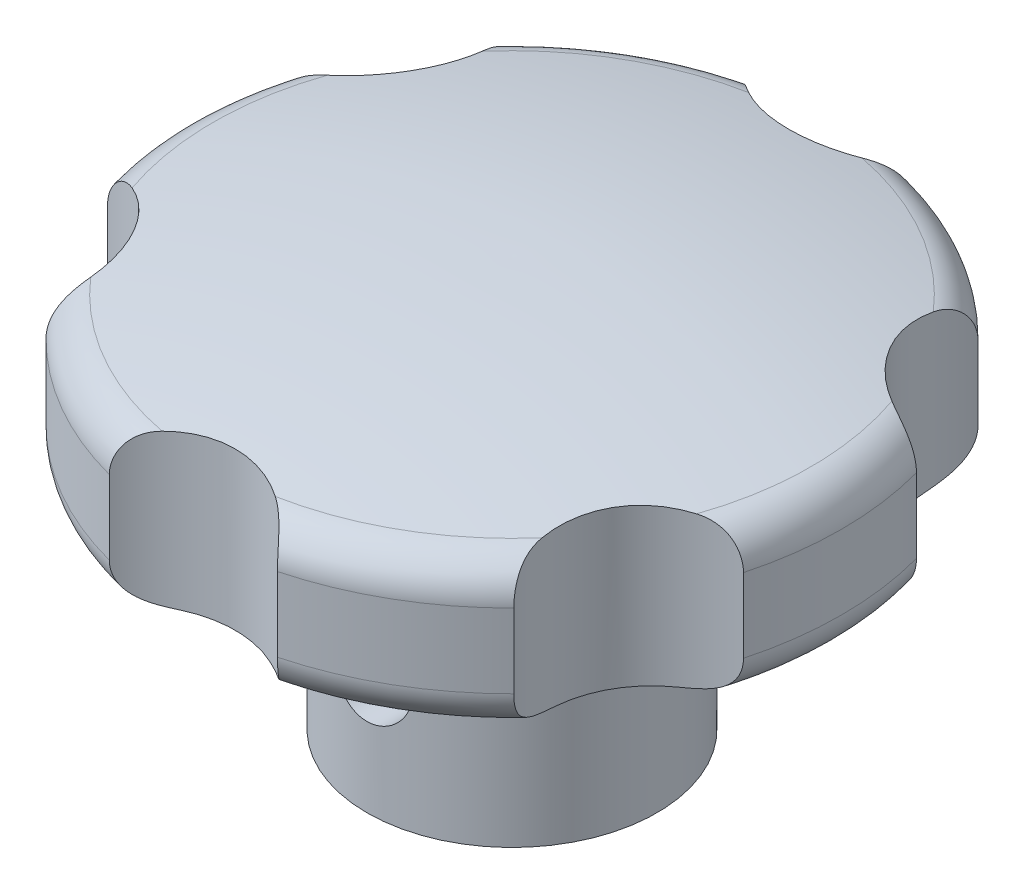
SolidWorks part; units mm, degrees
ref_plane "前基準面" through (0, 0, 0) normal (0, 0, 1) x (1, 0, 0)
ref_plane "上基準面" through (0, 0, 0) normal (0, 1, 0) x (1, 0, 0)
ref_plane "右基準面" through (0, 0, 0) normal (1, 0, 0) x (0, 0, -1)
sketch "草圖1" plane through (0, 0, 0) normal (1, 0, 0) x (0, 0, -1)
  line L0 (0, 0) -> (11, 0)
  line L1 (11, 0) -> (11, 17)
  line L2 (11, 17) -> (25, 17)
  line L3 (25, 17) -> (25, 28)
  line L4 (0, 0) -> (0, 31)
  arc A1 (0, 31) -> (25, 28) centre (0.6803, -68.9977) cw
  dimension "D1" = 11
  dimension "D7" = 100
  dimension "D2" = 17
  dimension "D3" = 31
  dimension "D4" = 25
  dimension "D5" = 11
revolve "旋轉1" add sketch "草圖1" angle 360 about L4
fillet "圓角1" radius 3 3 edges at (0, 17, -11) (0, 17, -25) (0, 28, -25)
sketch "草圖2" plane through (0, 17, 0) normal (0, -1, 0) x (1, 0, 0)
  circle A1 centre (0, 29) radius 8
  dimension "D1" = 29
  dimension "D2" = 16
extrude "除料-伸長1" cut sketch "草圖2" against normal through all
pattern_circular "環狀複製排列1" count 6 over 360 about axis through (0, 0, 0) along (0, 1, 0) of "除料-伸長1"
hole_wizard "Ø10.0mm 定位孔1" positions "草圖6" profile "草圖7" hole size "Ø10.0" standard "ISO"
sketch "草圖6" plane through (0, 0, 0) normal (0, -1, 0) x (-1, 0, 0)
  point P0 (0, 0)
sketch "草圖7" plane through (0, 0, 0) normal (1, 0, 0) x (0, 0, -1)
  line L0 (0, 0) -> (0, 21.0043)
  line L1 (0, 21.0043) -> (5, 18)
  line L2 (5, 18) -> (5, 0)
  line L5 (5, 0) -> (0, 0)
  line L10 (0, 21.0043) -> (-5, 18) construction
  line L11 (0, -6.35) -> (0, 107.95) construction
  dimension "鑽孔直徑" = 10
  dimension "鑽孔深度" = 18
  dimension "導頭角度" = 118
sketch "草圖8" plane through (0, 0, 0) normal (0, 0, 1) x (1, 0, 0)
  line L0 (-11, 0) -> (11, 0) construction
  circle A0 centre (0, 9) radius 3
  dimension "D1" = 9
extrude "除料-伸長3" cut sketch "草圖8" along normal blind 11
sketch "草圖9" plane through (0, 0, 0) normal (0, 0, 1) x (1, 0, 0)
  line L0 (0, 0) -> (0, 4.059) construction
pattern_circular "環狀複製排列3" count 2 over 120 about axis through (0, 0, 0) along (0, 1, 0) of "除料-伸長3"
